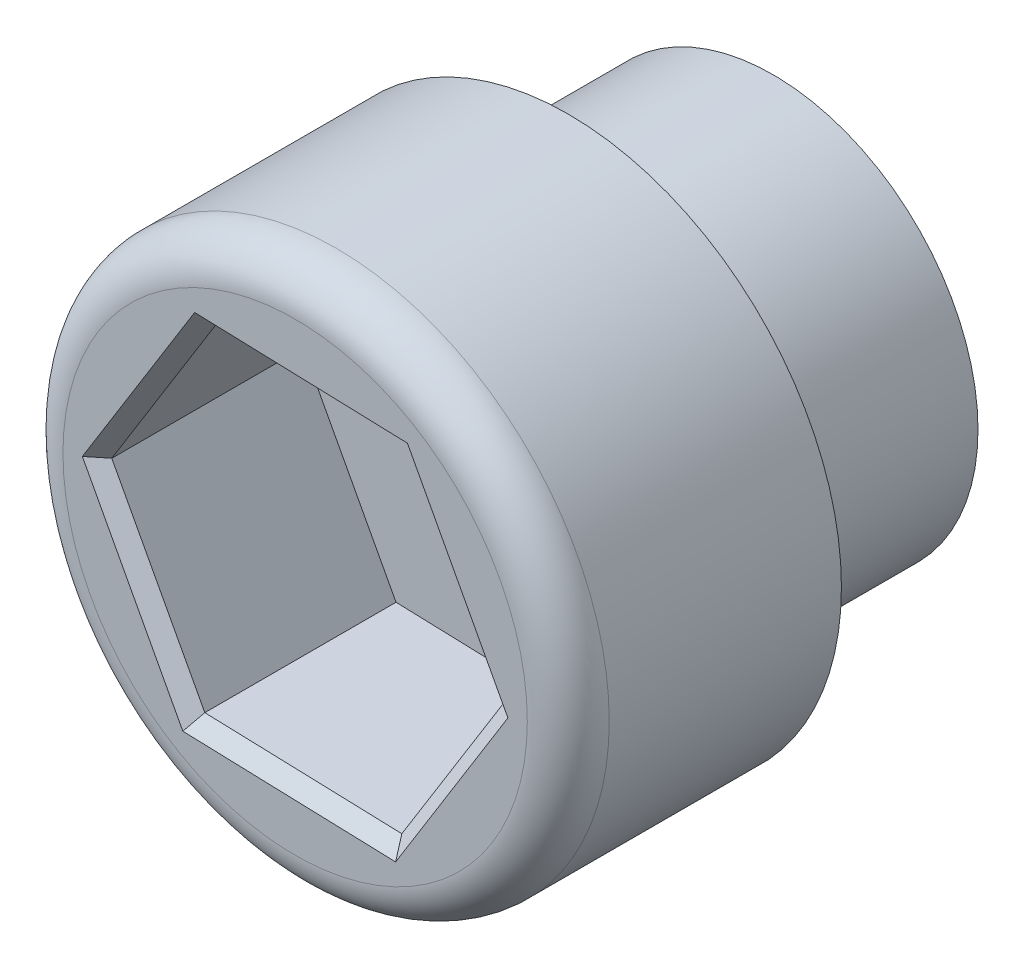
SolidWorks part; units mm, degrees
ref_plane "Płaszczyzna przednia" through (0, 0, 0) normal (0, 0, 1) x (1, 0, 0)
ref_plane "Płaszczyzna górna" through (0, 0, 0) normal (0, 1, 0) x (1, 0, 0)
ref_plane "Płaszczyzna prawa" through (0, 0, 0) normal (1, 0, 0) x (0, 0, -1)
sketch "Szkic1" plane through (0, 0, 0) normal (0, 0, 1) x (1, 0, 0)
  circle A0 centre (0, 0) radius 3
  dimension "D1" = 6
extrude "Dodanie-wyciągnięcie1" add sketch "Szkic1" along normal blind 3
sketch "Szkic2" plane through (0, 0, 3) normal (0, 0, 1) x (1, 0, 0)
  circle A0 centre (0, 0) radius 4
  dimension "D1" = 8
extrude "Dodanie-wyciągnięcie2" add sketch "Szkic2" along normal blind 4
sketch "Szkic3" plane through (0, 0, 7) normal (0, 0, 1) x (1, 0, 0)
  line L1 (-1.3624, 2.545) -> (-2.8853, 0.0926)
  line L2 (-2.8853, 0.0926) -> (-1.5229, -2.4524)
  line L3 (-1.5229, -2.4524) -> (1.3624, -2.545)
  line L4 (1.3624, -2.545) -> (2.8853, -0.0926)
  line L5 (2.8853, -0.0926) -> (1.5229, 2.4524)
  line L6 (1.5229, 2.4524) -> (-1.3624, 2.545)
  circle A0 centre (0, 0) radius 2.5 construction
  dimension "D1" = 5
extrude "Wytnij-wyciągnięcie1" cut sketch "Szkic3" against normal blind 3
fillet "Zaokrąglenie1" radius 0.6 1 edges at (4, 0, 7)
chamfer "Sfazowanie1" distance 0.2 angle 45 6 edges at (-0.0802, -2.4987, 7) (-2.2041, -1.1799, 7) (-2.1238, 1.3188, 7) (0.0802, 2.4987, 7) (2.2041, 1.1799, 7) (2.1238, -1.3188, 7)
